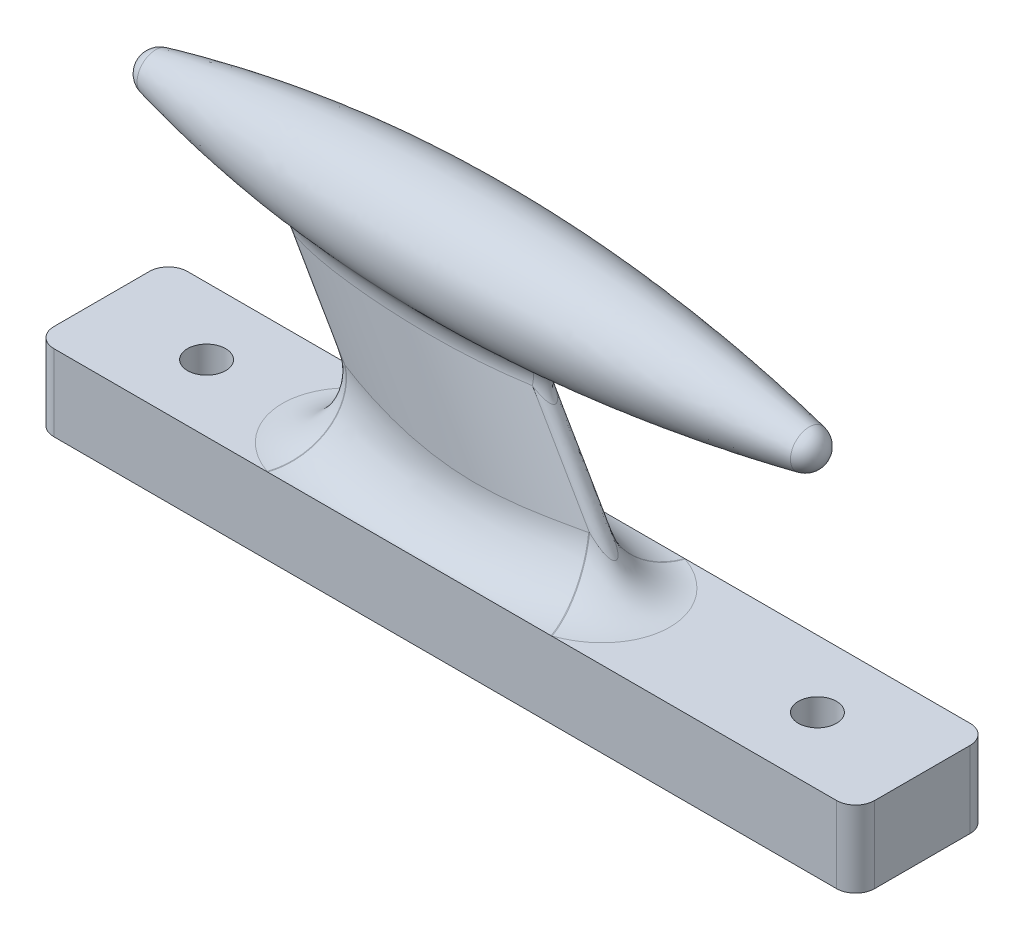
SolidWorks part; units mm, degrees
ref_plane "Front Plane" through (0, 0, 0) normal (0, 0, 1) x (1, 0, 0)
ref_plane "Top Plane" through (0, 0, 0) normal (0, 1, 0) x (1, 0, 0)
ref_plane "Right Plane" through (0, 0, 0) normal (1, 0, 0) x (0, 0, -1)
body saved out of another part "Stock-Boat Cleat_&-1"
